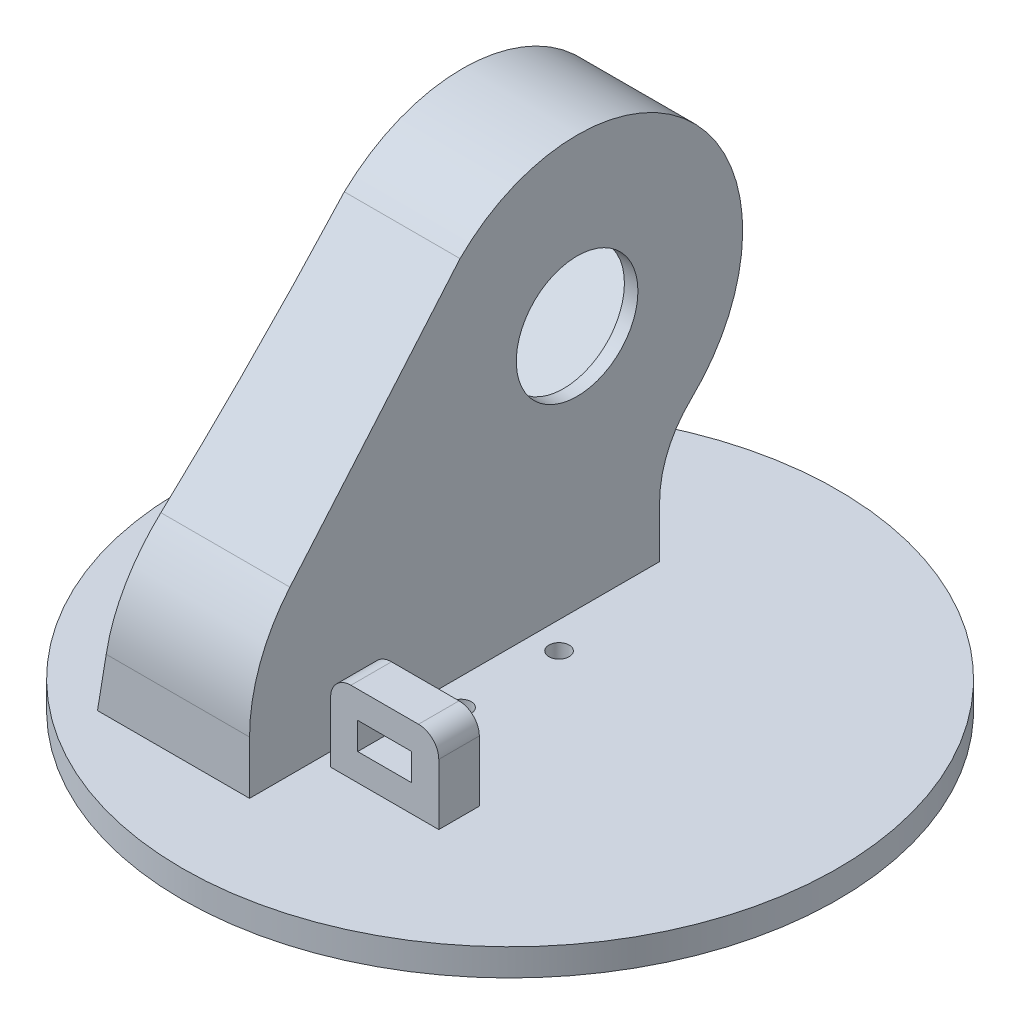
SolidWorks part; units mm, degrees
ref_plane "Front Plane" through (0, 0, 0) normal (0, 0, 1) x (1, 0, 0)
ref_plane "Top Plane" through (0, 0, 0) normal (0, 1, 0) x (1, 0, 0)
ref_plane "Right Plane" through (0, 0, 0) normal (1, 0, 0) x (0, 0, -1)
sketch "Sketch2" plane through (0, 0, 0) normal (0, 1, 0) x (1, 0, 0)
  circle A0 centre (0, 0) radius 48.5
  dimension "D1" = 97
extrude "Boss-Extrude1" add sketch "Sketch2" along normal blind 4
sketch "Sketch4" plane through (0, 0, 0) normal (0, -1, 0) x (1, 0, 0)
  circle A0 centre (0, 7.25) radius 1.5
  circle A1 centre (0, -7.25) radius 1.5
  dimension "D1" = 3
  dimension "D2" = 3
  dimension "D3" = 14.5
  dimension "D4" = 7.25
extrude "Cut-Extrude2" cut sketch "Sketch4" against normal through all
sketch "Sketch5" plane through (0, 0, 0) normal (0, -1, 0) x (1, 0, 0)
  circle A0 centre (0, 0) radius 3.75
  dimension "D1" = 7.5
extrude "Cut-Extrude3" cut sketch "Sketch5" against normal blind 1.5
ref_plane "Plane1" through (-4, 0, 0) normal (1, 0, 0) x (0, 0, -1)
sketch "Sketch7" plane through (-4, 0, 0) normal (1, 0, 0) x (0, 0, -1)
  line L0 (23.1299, 11.6445) -> (23.1299, 4)
  line L5 (48.5, 4) -> (-48.5, 4) construction
  line L6 (-27.2273, 29.5362) -> (-1.2843, 55.4793)
  line L7 (-43.5609, 4) -> (23.1299, 4)
  line L11 (-34.5496, 4) -> (-34.5496, 11.8586)
  arc A4 (28.7298, 24.692) -> (-1.2843, 55.4793) centre (13.9185, 40.2765) ccw
  arc A5 (28.7298, 24.692) -> (23.1299, 11.6445) centre (41.1299, 11.6445) ccw
  arc A6 (-27.2273, 29.5362) -> (-34.5496, 11.8586) centre (-9.5496, 11.8586) ccw
  dimension "D1" = 25
  dimension "D4" = 43
  dimension "D3" = 18
  dimension "D5" = 45
extrude "Boss-Extrude2" add sketch "Sketch7" against normal blind 14
ref_plane "Plane2" through (-6, 0, 0) normal (1, 0, 0) x (0, 0, -1)
sketch "Sketch8" plane through (-6, 0, 0) normal (1, 0, 0) x (0, 0, -1)
  line L0 (-27.2273, 29.5362) -> (-1.2843, 55.4793) construction
  line L1 (-15.2496, 25.9576) -> (13.7417, 54.9489)
  line L2 (-15.2496, 25.9576) -> (-0.4004, 11.1083)
  line L3 (-0.4004, 11.1083) -> (28.591, 40.0997)
  line L4 (13.7417, 54.9489) -> (28.591, 40.0997)
  line L5 (-15.2496, 25.9576) -> (28.591, 40.0997) construction
  line L6 (-0.4004, 11.1083) -> (13.7417, 54.9489) construction
  point P0 (6.6707, 33.0286)
  point P11 (13.9185, 40.2765)
  dimension "D1" = 41
  dimension "D2" = 21
  dimension "D3" = 90
  dimension "D4" = 20.5
  dimension "D5" = 90
  dimension "D6" = 10.25
  dimension "D7" = 10.5
extrude "Cut-Extrude5" cut sketch "Sketch8" against normal up to next
sketch "Sketch9" plane through (-18, 0, 0) normal (-1, 0, 0) x (0, 0, 1)
  line L0 (-13.7417, 54.9489) -> (-28.591, 40.0997) construction
  line L3 (-21.1664, 47.5243) -> (-22.536, 48.894) construction
  circle A0 centre (-20.1057, 53.5347) radius 1.3
  circle A1 centre (-27.1768, 46.4637) radius 1.3
  circle A2 centre (6.7644, 12.5225) radius 1.3
  circle A3 centre (13.8354, 19.5936) radius 1.3
  dimension "D1" = 2.6
  dimension "D5" = 5
  dimension "D6" = 90
  dimension "D2" = 3.5
  dimension "D3" = 2
  dimension "D4" = 2
extrude "Cut-Extrude6" cut sketch "Sketch9" against normal blind 7.5
sketch "Sketch11" plane through (-4, 0, 0) normal (1, 0, 0) x (0, 0, -1)
  circle A0 centre (13.9185, 40.2765) radius 9
  dimension "D1" = 18
extrude "Cut-Extrude9" cut sketch "Sketch11" against normal up to next
sketch "Sketch17" plane through (-18, 0, 0) normal (-1, 0, 0) x (0, 0, 1)
  line L0 (29.3486, 31.6576) -> (3.4056, 57.6006)
  line L1 (-26.1299, 11.6445) -> (-26.1299, 1)
  line L2 (-26.1299, 1) -> (37.5496, 1)
  line L3 (37.5496, 1) -> (37.5496, 11.8586)
  line L4 (27.2273, 29.5362) -> (1.2843, 55.4793)
  line L5 (-23.1299, 11.6445) -> (-23.1299, 4)
  line L6 (-23.1299, 4) -> (34.5496, 4)
  line L7 (34.5496, 4) -> (34.5496, 11.8586)
  line L9 (-23.1299, 11.6445) -> (-23.1299, 4)
  line L10 (-23.1299, 4) -> (34.5496, 4)
  line L11 (34.5496, 4) -> (34.5496, 11.8586)
  line L12 (-26.1299, 4) -> (37.5496, 4)
  line L13 (48.5, 4) -> (-48.5, 4) construction
  line L14 (3.4056, 57.6006) -> (28.5745, 28.0776)
  line L15 (1.2843, 55.4793) -> (26.295, 26.1272)
  line L16 (31.5496, 11.8586) -> (31.5496, 4)
  line L18 (27.2273, 29.5362) -> (1.2843, 55.4793) construction
  arc A0 (3.4056, 57.6006) -> (-30.7965, 22.5174) centre (-13.9185, 40.2765) ccw
  arc A1 (-26.1299, 11.6445) -> (-30.7965, 22.5174) centre (-41.1299, 11.6445) ccw
  arc A2 (37.5496, 11.8586) -> (29.3486, 31.6576) centre (9.5496, 11.8586) ccw
  arc A3 (1.2843, 55.4793) -> (-28.7298, 24.692) centre (-13.9185, 40.2765) ccw
  arc A4 (-23.1299, 11.6445) -> (-28.7298, 24.692) centre (-41.1299, 11.6445) ccw
  arc A5 (34.5496, 11.8586) -> (27.2273, 29.5362) centre (9.5496, 11.8586) ccw
  arc A6 (1.2843, 55.4793) -> (-28.7298, 24.692) centre (-13.9185, 40.2765) ccw
  arc A7 (-23.1299, 11.6445) -> (-28.7298, 24.692) centre (-41.1299, 11.6445) ccw
  arc A8 (34.5496, 11.8586) -> (27.2273, 29.5362) centre (9.5496, 11.8586) ccw
  arc A9 (31.5496, 11.8586) -> (25.106, 27.4149) centre (9.5496, 11.8586) ccw
  dimension "D1" = 0
  dimension "D2" = 3
  dimension "D3" = 3
extrude "Boss-Extrude7" add sketch "Sketch17" along normal blind 9 and the other way up to surface contours A9 L16 L12 L15 M21 M22 M16 | A1 L1 L12 L14 A0 M19 M18 M17 M16 M22
sketch "Sketch25" plane through (-18, 0, 0) normal (-1, 0, 0) x (0, 0, 1)
  line L0 (-23.1299, 11.6445) -> (-23.1299, 4)
  line L1 (48.5, 4) -> (-48.5, 4) construction
  line L2 (-23.1299, 11.6445) -> (-23.1299, 4) construction
  line L3 (1.2843, 55.4793) -> (26.295, 26.1272) construction
  line L4 (31.5496, 4) -> (-23.1299, 4) construction
  line L5 (31.5496, 11.8586) -> (31.5496, 4) construction
  line L6 (31.5496, 4) -> (-23.1299, 4)
  line L7 (31.5496, 11.8586) -> (31.5496, 4)
  line L8 (1.2843, 55.4793) -> (26.295, 26.1272)
  arc A0 (-23.1299, 11.6445) -> (-28.7298, 24.692) centre (-41.1299, 11.6445) ccw construction
  arc A1 (1.2843, 55.4793) -> (-28.7298, 24.692) centre (-13.9185, 40.2765) ccw construction
  arc A2 (-23.1299, 11.6445) -> (-28.7298, 24.692) centre (-41.1299, 11.6445) ccw
  arc A3 (31.5496, 11.8586) -> (26.295, 26.1272) centre (9.5496, 11.8586) ccw construction
  arc A4 (31.5496, 11.8586) -> (26.295, 26.1272) centre (9.5496, 11.8586) ccw
  spline S0 degree 3 poles (-28.7298, 24.692) (-21.9549, 18.2532) (-19.0941, 12.798) (-15.1299, 4) knots 0 0 0 0 1 1 1 1
  spline S1 degree 2 poles (11.7516, 43.195) (26.5513, 25.8264) (25.5496, 4) knots 0 0 0 1 1 1
  dimension "D2" = 8
  dimension "D1" = 6
extrude "Boss-Extrude10" add sketch "Sketch25" along normal up to surface (9 mm away) contours S0 L6 L0 A2 | A4 S1 A2 S0 L8
sketch "Sketch26" plane through (0, 0, 0) normal (0, 0, 1) x (1, 0, 0)
  line L0 (-4, 64.7765) -> (-27, 64.7765) construction
  line L1 (-27, 4) -> (-4, 4) construction
  line L2 (-27, 4) -> (-27, 11.8586) construction
  line L3 (-26, 64.7765) -> (-27, 64.7765)
  line L4 (-27, 64.7765) -> (-27, 4)
  line L5 (-27, 4) -> (-23, 4)
  spline S0 degree 2 poles (-26, 64.7765) (-24.7724, 34.3751) (-23, 4) knots 0 0 0 1 1 1
  dimension "D1" = 1
  dimension "D2" = 4
  dimension "D3" = 2
extrude "Cut-Extrude15" [suppressed] cut sketch "Sketch26" against normal through all both and the other way through all contours L4 L5 S0 L3
sketch "Sketch27" plane through (0, 4, 0) normal (0, 1, 0) x (1, 0, 0)
  line L1 (-2, -18.5496) -> (14, -18.5496)
  line L2 (-2, -18.5496) -> (-2, -24.5496)
  line L3 (-2, -24.5496) -> (14, -24.5496)
  line L4 (14, -18.5496) -> (14, -24.5496)
  line L5 (-27, -34.5496) -> (-4, -34.5496) construction
  line L6 (-4, -34.5496) -> (-4, 26.1299) construction
  dimension "D1" = 10
  dimension "D2" = 6
  dimension "D3" = 16
  dimension "D4" = 2
extrude "Boss-Extrude11" add sketch "Sketch27" along normal blind 12
fillet "Fillet6" radius 3 2 edges at (14, 16, 21.5496) (-2, 16, 21.5496)
sketch "Sketch28" plane through (0, 0, 24.5496) normal (0, 0, 1) x (1, 0, 0)
  line L8 (10, 12) -> (2, 12)
  line L9 (2, 12) -> (2, 8)
  line L10 (2, 8) -> (10, 8)
  line L11 (10, 8) -> (10, 12)
  line L12 (10, 12) -> (2, 12)
  line L13 (2, 12) -> (2, 8)
  line L14 (2, 8) -> (10, 8)
  line L15 (10, 8) -> (10, 12)
  dimension "D1" = 4
extrude "Cut-Extrude16" cut sketch "Sketch28" against normal up to next
sketch "Sketch29" plane through (0, 0, 0) normal (0, 0, 1) x (1, 0, 0)
  line L0 (-4, 64.7765) -> (-27, 64.7765) construction
  line L1 (-27, 4) -> (-4, 4) construction
  line L2 (-21, 64.7765) -> (-27, 64.7765)
  line L3 (-27, 64.7765) -> (-27, 4)
  line L4 (-27, 4) -> (-26.5, 4)
  line L5 (48.5, 4) -> (-48.5, 4) construction
  spline S0 degree 2 poles (-21, 64.7765) (-21.2205, 34.1409) (-26.5, 4) knots 0 0 0 1 1 1
  dimension "D1" = 6
  dimension "D2" = 4
  dimension "D3" = 0.5
  dimension "D4" = 25
extrude "Cut-Extrude17" cut sketch "Sketch29" against normal through all both and the other way through all
